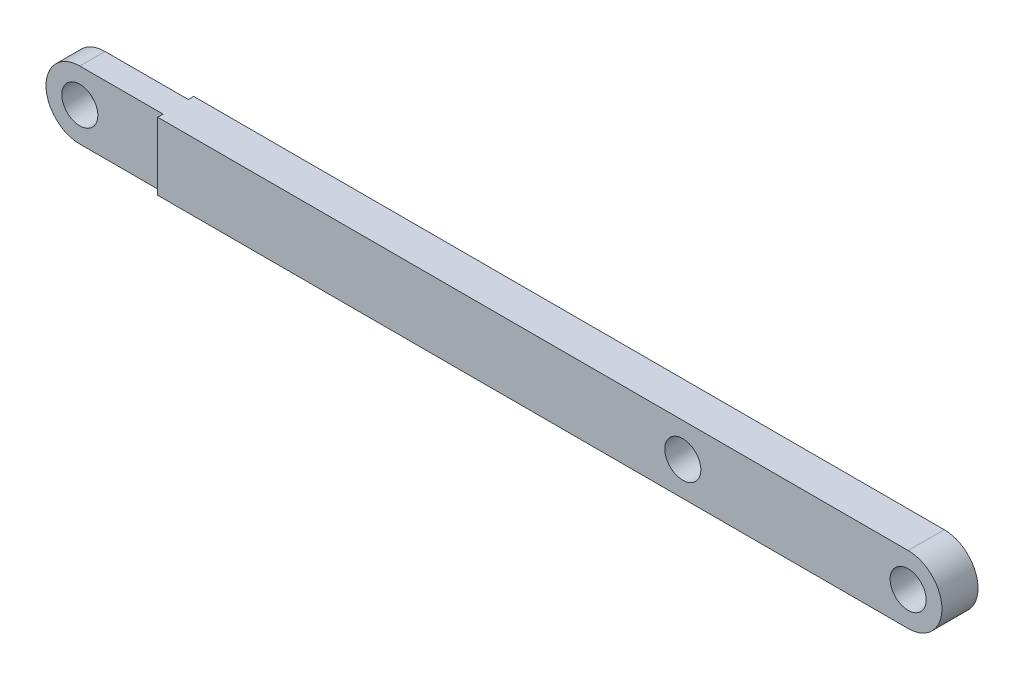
SolidWorks part; units mm, degrees
ref_plane "Front Plane" through (0, 0, 0) normal (0, 0, 1) x (1, 0, 0)
ref_plane "Top Plane" through (0, 0, 0) normal (0, 1, 0) x (1, 0, 0)
ref_plane "Right Plane" through (0, 0, 0) normal (1, 0, 0) x (0, 0, -1)
sketch "Sketch1" plane through (0, 0, 0) normal (0, 0, 1) x (1, 0, 0)
  line L0 (-88.4783, 0) -> (96.5217, 0) construction
  line L1 (-88.4783, 0) -> (96.5217, 0) construction
  line L2 (-88.4783, 7.5) -> (96.5217, 7.5)
  line L3 (-88.4783, -7.5) -> (96.5217, -7.5)
  arc A0 (-88.4783, 7.5) -> (-88.4783, -7.5) centre (-88.4783, 0) ccw
  arc A1 (96.5217, -7.5) -> (96.5217, 7.5) centre (96.5217, 0) ccw
  circle A2 centre (-88.4783, 0) radius 4
  circle A3 centre (96.5217, 0) radius 4
  circle A4 centre (46.5217, 0) radius 4
  point P3 (4.0217, 0)
  dimension "D3" = 8
  dimension "D4" = 8
  dimension "D6" = 8
  dimension "D1" = 185
  dimension "D2" = 15
  dimension "D5" = 50
extrude "Boss-Extrude1" add sketch "Sketch1" along normal blind 8
ref_plane "Plane2" through (-70, 0, 0) normal (1, 0, 0) x (0, 0, -1)
sketch "Sketch3" plane through (-70, 0, 0) normal (1, 0, 0) x (0, 0, -1)
  line L0 (-8, 7.5) -> (0, 7.5) construction
  line L1 (-6.8, 7.5) -> (-8, 7.5)
  line L2 (-6.8, 7.5) -> (-6.8, -7.5)
  line L3 (-6.8, -7.5) -> (-8, -7.5)
  line L4 (-8, 7.5) -> (-8, -7.5)
  line L6 (-1.2, 7.5) -> (0, 7.5)
  line L7 (-1.2, 7.5) -> (-1.2, -7.5)
  line L8 (-1.2, -7.5) -> (0, -7.5)
  line L9 (0, 7.5) -> (0, -7.5)
  dimension "D1" = 1.2
  dimension "D2" = 1.2
extrude "Cut-Extrude1" cut sketch "Sketch3" against normal blind 31
